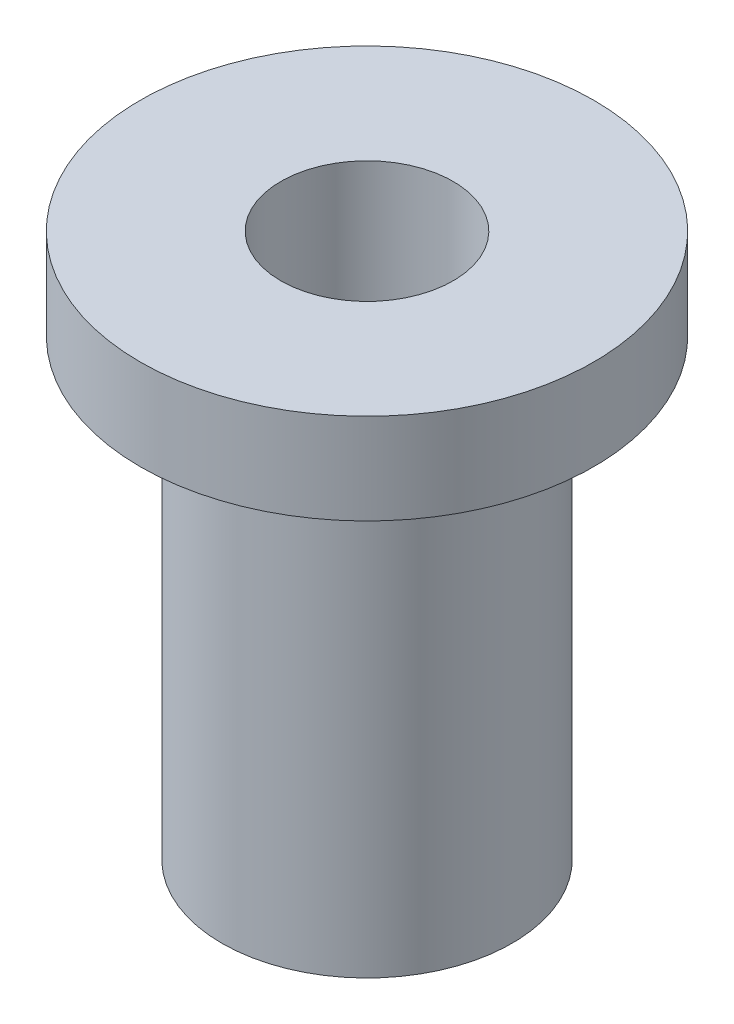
SolidWorks part; units mm, degrees
ref_plane "Front Plane" through (0, 0, 0) normal (0, 0, 1) x (1, 0, 0)
ref_plane "Top Plane" through (0, 0, 0) normal (0, 1, 0) x (1, 0, 0)
ref_plane "Right Plane" through (0, 0, 0) normal (1, 0, 0) x (0, 0, -1)
sketch "Sketch2" plane through (0, 0, 0) normal (0, 1, 0) x (1, 0, 0)
  circle A0 centre (-11.6742, 13.7968) radius 12.5
extrude "Boss-Extrude1" add sketch "Sketch2" along normal blind 30
sketch "Sketch3" plane through (0, 30, 0) normal (0, 1, 0) x (1, 0, 0)
  circle A0 centre (-11.6742, 13.7968) radius 4.75
  circle A1 centre (-11.6742, 13.7968) radius 12.5 construction
  dimension "D1" = 0
extrude "Cut-Extrude1" cut sketch "Sketch3" against normal blind 30
sketch "Sketch4" plane through (0, 0, 0) normal (0, -1, 0) x (-1, 0, 0)
  circle A0 centre (11.6742, 13.7968) radius 8
extrude "Cut-Extrude2" cut sketch "Sketch4" against normal blind 25 flip side to cut contours A0
